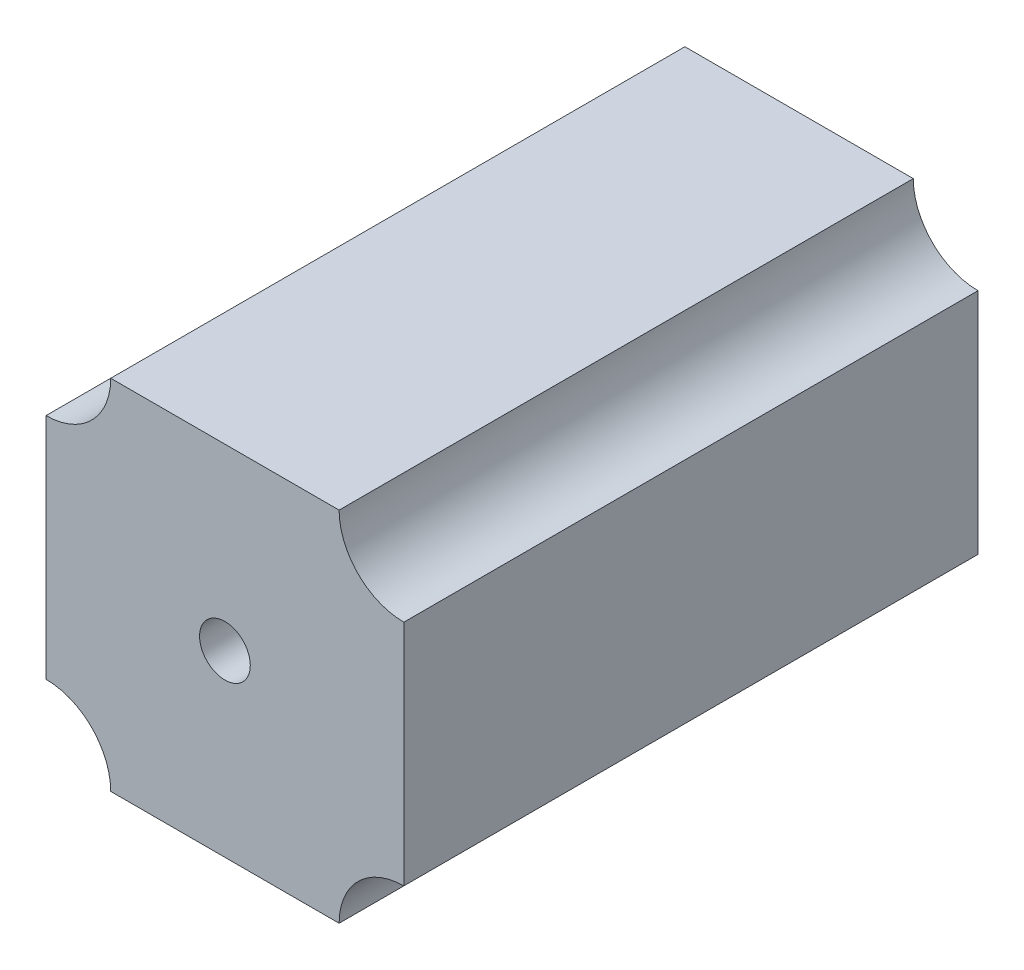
SolidWorks part; units mm, degrees
ref_plane "前视" through (0, 0, 0) normal (0, 0, 1) x (1, 0, 0)
ref_plane "上视" through (0, 0, 0) normal (0, 1, 0) x (1, 0, 0)
ref_plane "右视" through (0, 0, 0) normal (1, 0, 0) x (0, 0, -1)
sketch "草图1" plane through (0, 0, 0) normal (0, 0, 1) x (1, 0, 0)
  line L1 (18, -28.2) -> (-18, -28.2)
  line L2 (28.2, -18) -> (28.2, 18)
  line L3 (18, 28.2) -> (-18, 28.2)
  line L4 (-28.2, -18) -> (-28.2, 18)
  line L5 (28.2, -28.2) -> (-28.2, 28.2) construction
  line L6 (28.2, 28.2) -> (-28.2, -28.2) construction
  line L11 (18, -28.2) -> (-18, 28.2) construction
  line L12 (18, 28.2) -> (-18, -28.2) construction
  line L17 (28.2, -18) -> (-28.2, 18) construction
  line L18 (28.2, 18) -> (-28.2, -18) construction
  arc A0 (-28.2, 18) -> (-18, 28.2) centre (-28.2, 28.2) ccw
  arc A1 (18, 28.2) -> (28.2, 18) centre (28.2, 28.2) ccw
  arc A2 (28.2, -18) -> (18, -28.2) centre (28.2, -28.2) ccw
  arc A3 (-28.2, -18) -> (-18, -28.2) centre (-28.2, -28.2) cw
  point P0 (0, 0)
  point P6 (0, 0)
  point P11 (0, 0)
  dimension "D1" = 56.4
  dimension "D2" = 56.4
  dimension "D3" = 36
  dimension "D4" = 36
extrude "凸台-拉伸1" add sketch "草图1" along normal blind 90.5
sketch "草图2" plane through (0, 0, 90.5) normal (0, 0, 1) x (1, 0, 0)
  circle A0 centre (0, 0) radius 4
extrude "切除-拉伸1" cut sketch "草图2" against normal blind 90.5
